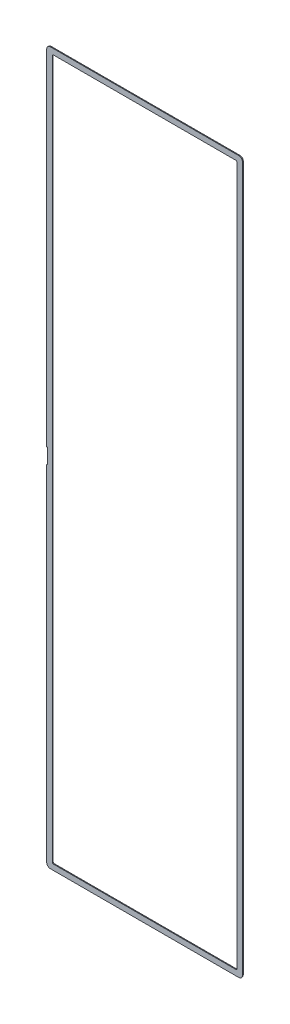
SolidWorks part; units mm, degrees
ref_plane "前视基准面" through (0, 0, 0) normal (0, 0, 1) x (1, 0, 0)
ref_plane "上视基准面" through (0, 0, 0) normal (0, 1, 0) x (1, 0, 0)
ref_plane "右视基准面" through (0, 0, 0) normal (1, 0, 0) x (0, 0, -1)
sketch "草图1" plane through (0, 0, 0) normal (0, 0, 1) x (1, 0, 0)
  line L0 (250.5, -950.5) -> (250.5, 950.5)
  line L1 (-255.5, -965.5) -> (255.5, -965.5)
  line L2 (-265.5, -955.5) -> (-265.5, 955.5)
  line L3 (-255.5, 965.5) -> (255.5, 965.5)
  line L4 (265.5, -955.5) -> (265.5, 955.5)
  line L5 (-265.5, -965.5) -> (265.5, 965.5) construction
  line L6 (-265.5, 965.5) -> (265.5, -965.5) construction
  line L7 (-250.5, 950.5) -> (250.5, 950.5)
  line L8 (-250.5, -950.5) -> (-250.5, 950.5)
  line L9 (-250.5, -950.5) -> (250.5, -950.5)
  arc A0 (-255.5, -965.5) -> (-265.5, -955.5) centre (-255.5, -955.5) cw
  arc A1 (255.5, -965.5) -> (265.5, -955.5) centre (255.5, -955.5) ccw
  arc A2 (-265.5, 955.5) -> (-255.5, 965.5) centre (-255.5, 955.5) cw
  arc A3 (255.5, 965.5) -> (265.5, 955.5) centre (255.5, 955.5) cw
  arc A4 (250.5, 950.5) -> (250.5, 950.5) centre (250.5, 950.5) cw
  arc A5 (-250.5, 950.5) -> (-250.5, 950.5) centre (-250.5, 950.5) cw
  arc A6 (-250.5, -950.5) -> (-250.5, -950.5) centre (-250.5, -950.5) cw
  arc A7 (250.5, -950.5) -> (250.5, -950.5) centre (250.5, -950.5) ccw
  point P0 (0, 0)
  dimension "D3" = 10
  dimension "D1" = 531
  dimension "D2" = 1931
  dimension "D4" = 15
extrude "拉伸1" add sketch "草图1" along normal blind 4
fillet "圆角1" radius 3 16 edges at (-262.5711, -962.5711, 0) (-265.5, 0, 0) (-262.5711, 962.5711, 0) (0, 965.5, 0) (262.5711, 962.5711, 0) (265.5, 0, 0) (262.5711, -962.5711, 0) (0, -965.5, 0) (250.5, -950.5, 2) (-250.5, -950.5, 2) (0, -950.5, 0) (-250.5, 950.5, 2) (-250.5, 0, 0) (250.5, 950.5, 2) (250.5, 0, 0) (0, 950.5, 0)
sketch "草图2" plane through (0, 0, 4) normal (0, 0, 1) x (1, 0, 0)
  line L0 (-269.75, -20.5) -> (-263.25, -20.5) construction
  line L1 (-263.1734, 20.5) -> (-267.5, 20.5)
  line L2 (-263.1734, 20.5) -> (-263.1734, -20.5)
  line L3 (-263.1734, -20.5) -> (-267.5, -20.5)
  line L4 (-267.5, 20.5) -> (-267.5, -20.5)
  line L6 (-265.5, 955.5) -> (-265.5, -955.5) construction
  dimension "D1" = 4.3266
  dimension "D2" = 41
  dimension "D3" = 2
extrude "切除-拉伸1" cut sketch "草图2" against normal through all
